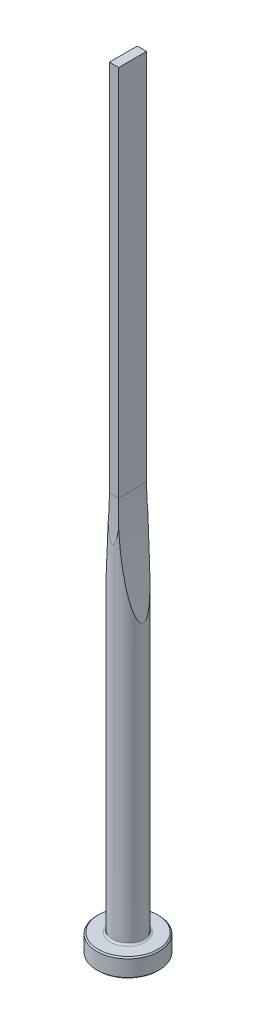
SolidWorks part; units mm, degrees
ref_plane "Front Plane" through (0, 0, 0) normal (0, 0, 1) x (1, 0, 0)
ref_plane "Top Plane" through (0, 0, 0) normal (0, 1, 0) x (1, 0, 0)
ref_plane "Right Plane" through (0, 0, 0) normal (1, 0, 0) x (0, 0, -1)
sketch "Sketch1" plane through (0, 0, 0) normal (0, 0, 1) x (1, 0, 0)
  line L0 (0, 0) -> (4.8, 0)
  line L1 (55, 0) -> (-55, 0) construction
  line L2 (5, 0.2) -> (5, 2.8)
  line L3 (4.8, 3) -> (2.8, 3)
  line L4 (2.5, 3.3) -> (2.5, 125)
  line L5 (0, 125) -> (2.5, 125)
  line L6 (5, 2.8) -> (4.8, 3)
  line L7 (4.8, 0) -> (5, 0.2)
  line L8 (0, 125) -> (0, 0)
  arc A0 (2.5, 3.3) -> (2.8, 3) centre (2.8, 3.3) ccw
  point P1 (5, 0)
  point P6 (5, 3)
  dimension "D4" = 0.3
  dimension "D1" = 2.5
  dimension "D2" = 5
  dimension "D3" = 3
  dimension "D5" = 125
revolve "Revolve1" add sketch "Sketch1" angle 360 about L8
sketch "Sketch2" plane through (0, 0, 0) normal (0, 0, 1) x (1, 0, 0)
  line L0 (0.75, 125) -> (0.75, 65)
  line L1 (2.5, 125) -> (-2.5, 125) construction
  line L2 (-0.75, 125) -> (-0.75, 65)
  line L3 (2.5, 125) -> (2.5, 47.3382)
  line L4 (-2.5, 125) -> (-2.5, 47.3382)
  line L5 (0, -5.5) -> (0, 5.5) construction
  line L6 (2.5, 125) -> (0.75, 125)
  line L8 (-0.75, 125) -> (-2.5, 125)
  arc A0 (0.75, 65) -> (2.5, 47.3382) centre (90.75, 65) ccw
  arc A1 (-0.75, 65) -> (-2.5, 47.3382) centre (-90.75, 65) cw
  dimension "D4" = 90
  dimension "D1" = 60
  dimension "D2" = 1.5
  dimension "D3" = 0.75
extrude "Cut-Extrude1" cut sketch "Sketch2" against normal mid plane 10
sketch "Sketch3" plane through (0, 0, 0) normal (1, 0, 0) x (0, 0, -1)
  line L0 (2.25, 125) -> (2.25, 65)
  line L1 (-2.3848, 125) -> (2.3848, 125) construction
  line L2 (-2.25, 125) -> (-2.25, 65)
  line L3 (2.5, 125) -> (2.5, 58.2965)
  line L4 (2.25, 125) -> (2.5, 125)
  line L5 (0, 5.5) -> (0, -5.5) construction
  line L6 (-2.5, 125) -> (-2.5, 58.2965)
  line L8 (-2.25, 125) -> (-2.5, 125)
  arc A0 (2.25, 65) -> (2.5, 58.2965) centre (92.25, 65) ccw
  arc A1 (-2.25, 65) -> (-2.5, 58.2965) centre (-92.25, 65) cw
  dimension "D2" = 90
  dimension "D1" = 60
  dimension "D3" = 4.5
  dimension "D4" = 2.25
extrude "Cut-Extrude2" cut sketch "Sketch3" against normal mid plane 10
